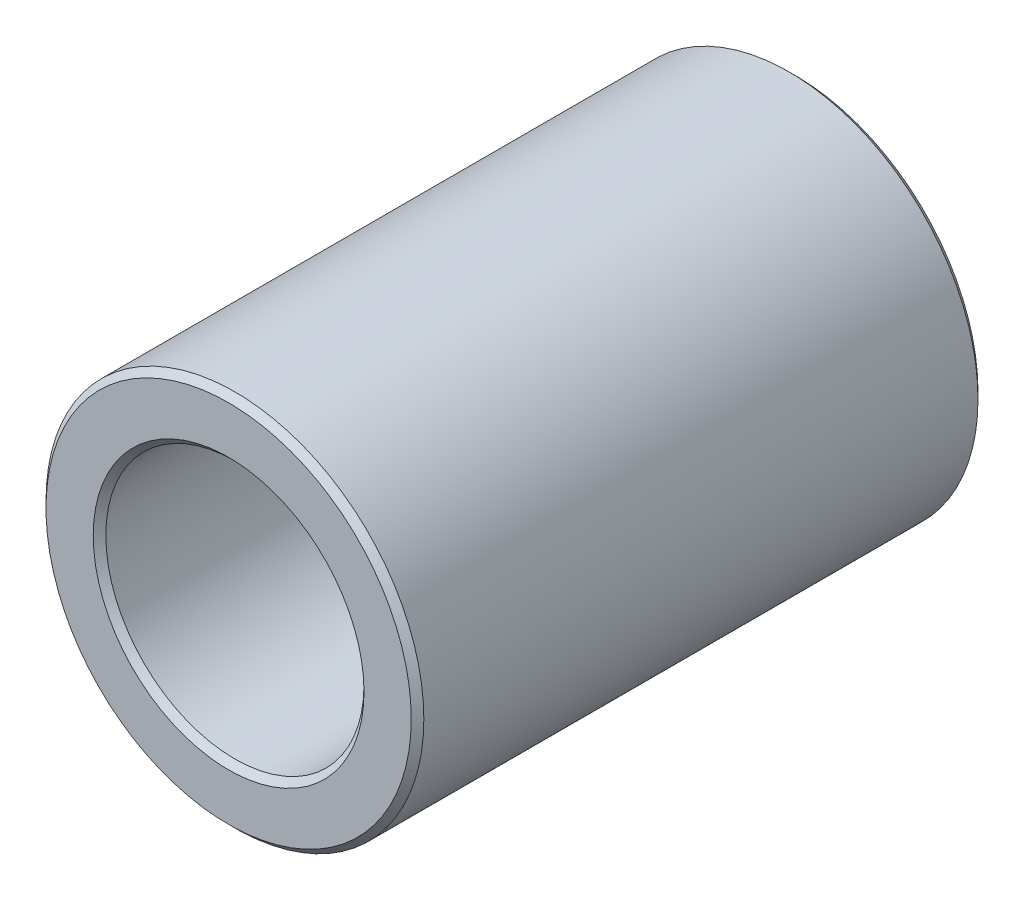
SolidWorks part; units mm, degrees
ref_plane "Front Plane" through (0, 0, 0) normal (0, 0, 1) x (1, 0, 0)
ref_plane "Top Plane" through (0, 0, 0) normal (0, 1, 0) x (1, 0, 0)
ref_plane "Right Plane" through (0, 0, 0) normal (1, 0, 0) x (0, 0, -1)
sketch "Sketch1" plane through (0, 0, 0) normal (0, 0, 1) x (1, 0, 0)
  circle A0 centre (0, 0) radius 6
  circle A1 centre (0, 0) radius 4.1
  dimension "D1" = 12
  dimension "D2" = 8.2
extrude "Boss-Extrude2" add sketch "Sketch1" along normal mid plane 18
chamfer "Chamfer3" distance 0.2 angle 45 4 edges at (6, 0, 9) (6, 0, -9) (4.1, 0, -9) (4.1, 0, 9)
